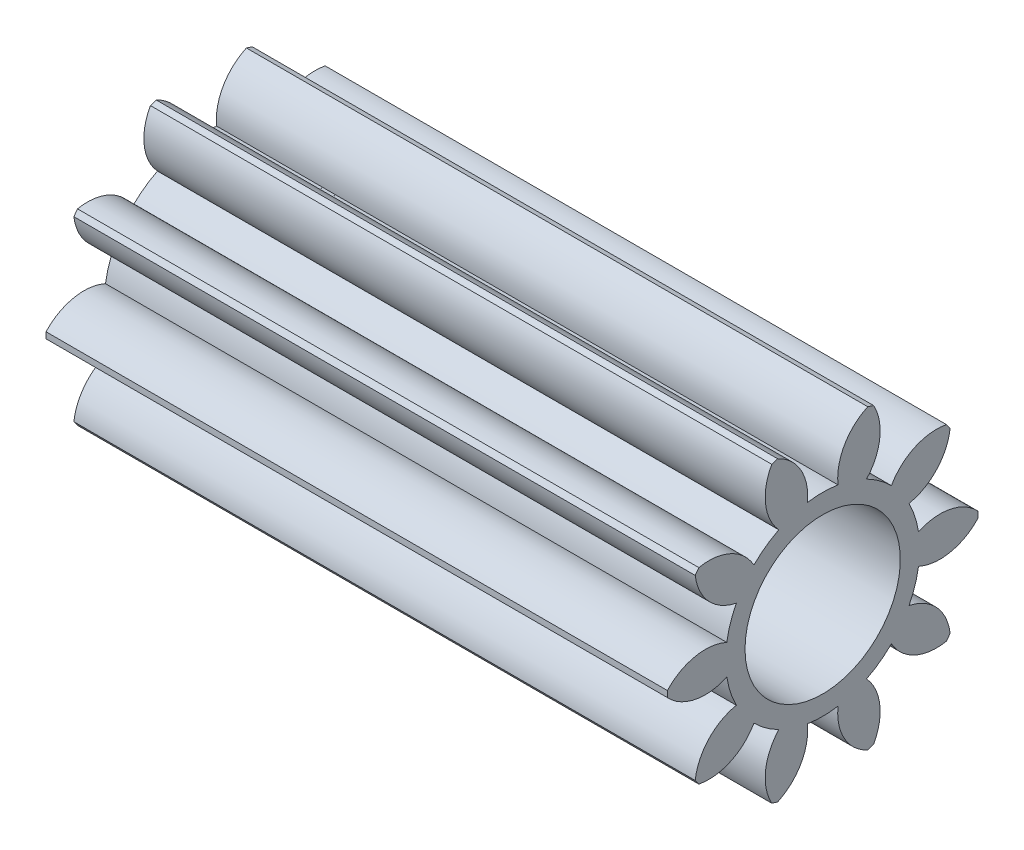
SolidWorks part; units mm, degrees
ref_plane "Plane1" through (0, 0, 0) normal (0, 0, 1) x (1, 0, 0)
ref_plane "Plane2" through (0, 0, 0) normal (0, 1, 0) x (1, 0, 0)
ref_plane "Plane3" through (0, 0, 0) normal (1, 0, 0) x (0, 0, -1)
sketch "HoldingSke" plane through (0, 0, 0) normal (0, 1, 0) x (1, 0, 0)
  line L0 (0, 0) -> (1.9696, -0.3473)
  line L1 (-15, 0) -> (100, 0) construction
  line L2 (0, 0) -> (-2.1039, 2.3779)
  line L3 (0, 0) -> (-11.863, 4.5341)
  line L4 (0, 0) -> (8.5048, 1.4996)
  line L5 (0, 0) -> (-46.8476, -17.4728)
  line L6 (0, 0) -> (-9.9476, -6.7116)
  line L7 (-2.1039, 2.3779) -> (8.6586, 51.2059)
  line L8 (-76.2, 54.61) -> (-75.7, 54.61)
  line L9 (-71.009, 38.7566) -> (-53.1078, 45.2721)
  line L10 (-76.2, 71.12) -> (104.1128, 71.12)
  line L11 (0, 0) -> (-12, 0)
  line L12 (-76.2, 101.6) -> (-76.181, 101.6)
  line L13 (24.9733, 27.94) -> (52.9518, 28.4284)
  line L14 (24.9733, 27.94) -> (24.9743, 27.94)
  line L15 (24.9733, 27.94) -> (100.4006, 29.5858)
  line L16 (-63.627, -0.5) -> (-12.827, -0.5)
  circle A0 centre (0, 0) radius 1.5
  circle A1 centre (0, 0) radius 1.874
  circle A2 centre (0, 0) radius 37.5
  circle A3 centre (0, 0) radius 1.5
sketch "BasProSke" plane through (0, 0, 0) normal (0, 1, 0) x (1, 0, 0)
  line L0 (-10, 0) -> (60, 0) construction
  line L1 (0, 0) -> (0, 3)
  line L2 (0, 0) -> (12, 0)
  line L3 (12, 0) -> (12, 3)
  line L4 (12, 3) -> (0, 3)
revolve "Base-Revolve" add sketch "BasProSke" angle 360 about L0
sketch "TooCutSke" plane through (0, 0, 0) normal (1, 0, 0) x (0, 0, -1)
  line L1 (0, 0) -> (0, 107) construction
  line L2 (0, 0) -> (-0.4243, 2.4637) construction
  line L3 (0, 0) -> (-1.5292, 4.7063) construction
  line L4 (-0.4243, 2.4637) -> (-0.7646, 2.3532) construction
  arc A0 (0.2964, 1.8504) -> (-0.2964, 1.8504) centre (0, 0) ccw
  arc A1 (0.9059, 2.8866) -> (-0.9059, 2.8866) centre (0, 0) ccw
  circle A2 centre (0, 0) radius 2.5 construction
  circle A3 centre (0, 0) radius 2.3492 construction
  arc A4 (-0.2964, 1.8504) -> (-0.9059, 2.8866) centre (-1.2901, 1.9633) ccw
  arc A5 (0.9059, 2.8866) -> (0.2964, 1.8504) centre (1.2901, 1.9633) ccw
extrude "ToothCut" cut sketch "TooCutSke" along normal through all
fillet "Breaks" [suppressed] radius 0.01
fillet "RootFillets" [suppressed] radius 0.126
pattern_circular "TeethCuts" count 10 every 36 about axis through (-10, 0, 0) along (1, 0, 0) of "ToothCut", "RootFillets", "Breaks"
sketch "HubNeaOneSke" plane through (0, 0, 0) normal (-1, 0, 0) x (0, 0, 1)
  circle A0 centre (0, 0) radius 1.874
extrude "HubNearOne" [suppressed] add sketch "HubNeaOneSke" along normal blind 38.0001
sketch "HubNeaBotSke" plane through (0, 0, 0) normal (-1, 0, 0) x (0, 0, 1)
  circle A0 centre (0, 0) radius 1.874
extrude "HubNearBoth" [suppressed] add sketch "HubNeaBotSke" along normal blind 19
ref_plane "FarPln" through (12, 0, 0) normal (1, 0, 0) x (0, 0, -1)
sketch "HubFarSke" plane through (12, 0, 0) normal (1, 0, 0) x (0, 0, -1)
  circle A0 centre (0, 0) radius 1.874
extrude "HubFar" [suppressed] add sketch "HubFarSke" along normal blind 19
sketch "BorSke" plane through (0, 0, 0) normal (1, 0, 0) x (0, 0, -1)
  circle A0 centre (0, 0) radius 1.5
extrude "Bore" cut sketch "BorSke" along normal mid plane 100.0001
sketch "KeySke" plane through (0, 0, 0) normal (1, 0, 0) x (0, 0, -1)
  line L0 (-0.6, 0) -> (-0.6, 2)
  line L1 (-0.6, 2) -> (0.6, 2)
  line L2 (0.6, 2) -> (0.6, 0)
  line L3 (0, 0) -> (0, 34) construction
  line L4 (-0.6, 0) -> (0.6, 0)
extrude "Keyway" [suppressed] cut sketch "KeySke" along normal mid plane 100.0001
pattern_circular "Keyway2" [suppressed] count 2 every 90 about axis through (-10, 0, 0) along (1, 0, 0)
equation "' \"Module@HoldingSke\" = 6.35"
equation "' \"Num_teeth@HoldingSke\" = 12"
equation "' \"Ap@HoldingSke\" =  20"
equation "' \"Ap@HoldingSke\" = 20"
equation "' \"Width@HoldingSke\" = 0.5 * 25.4"
equation "' \"Hub_dia@HoldingSke\"= 1 * 25.4"
equation "' \"Hub_dia@HoldingSke\" = 1 * 25.4"
equation "' \"Overall_len@HoldingSke\" = 1.0 * 25.4"
equation "' \"Bore@HoldingSke\" = 0.75 * 25.4"
equation "' \"T_dim@HoldingSke\" = 0.1 * 25.4"
equation "' \"Width@KeySke\" = 0.25 * 25.4"
equation "' \"Show_teeth@HoldingSke\" = 13"
equation "' \"Backlash@HoldingSke\" = 0.009 * 25.4"
equation "' \"Addendum_fac@HoldingSke\" = 1.0"
equation "' \"Dedendum_fac@HoldingSke\" = 1.25"
equation "' \"Dedendum_add@HoldingSke\" = 0.00005 * 25.4"
equation "' \"Clearance_fac@HoldingSke\" = 0.25"
equation "\"Pitch@HoldingSke\" = 1 / \"Module@HoldingSke\""
equation "\"Overcut_dia@TooCutSke\" = (\"Num_teeth@HoldingSke\" + 2 * \"Addendum_fac@HoldingSke\") / \"Pitch@HoldingSke\" + 0.002 * 25.4"
equation "\"Pitch_dia@TooCutSke\" = \"Num_teeth@HoldingSke\" / \"Pitch@HoldingSke\""
equation "\"Base_dia@TooCutSke\" = \"Num_teeth@HoldingSke\" / \"Pitch@HoldingSke\" * cos((\"Ap@HoldingSke\"  * 3.14159265 / 180))"
equation "\"Root_dia@TooCutSke\" = (\"Num_teeth@HoldingSke\" + 2) / \"Pitch@HoldingSke\" - 2 * (\"Addendum_fac@HoldingSke\" + \"Dedendum_fac@HoldingSke\") / \"Pitch@HoldingSke\" - \"Dedendum_add@HoldingSke\" * 2"
equation "\"Half_ang@TooCutSke\" = 180 / \"Num_teeth@HoldingSke\""
equation "\"Half_CT@TooCutSke\" = \"Num_teeth@HoldingSke\" / \"Pitch@HoldingSke\" * sin((3.14159265 / 2 / \"Num_teeth@HoldingSke\")) / 2 - 7 * \"Backlash@HoldingSke\" / 4"
equation "\"Flank_rad@TooCutSke\" = \"Num_teeth@HoldingSke\" / \"Pitch@HoldingSke\" / 5"
equation "\"Radius@RootFillets\" = \"Clearance_fac@HoldingSke\" / \"Pitch@HoldingSke\" + \"Dedendum_add@HoldingSke\""
equation "\"Break_rad@Breaks\" = 0.02 / \"Pitch@HoldingSke\""
equation "\"Thickness@HoldingSke\" = \"Width@HoldingSke\""
equation "\"OAL@HoldingSke\" = \"Thickness@HoldingSke\""
equation "\"MHD@HoldingSke\" = (\"Num_teeth@HoldingSke\" + 2) / \"Pitch@HoldingSke\" - 2 * (\"Addendum_fac@HoldingSke\" + \"Dedendum_fac@HoldingSke\")  / \"Pitch@HoldingSke\" - \"Dedendum_add@HoldingSke\" * 2"
equation "\"MBD@HoldingSke\" = (\"Num_teeth@HoldingSke\" + 2) / \"Pitch@HoldingSke\" - 2 * (\"Addendum_fac@HoldingSke\" + \"Dedendum_fac@HoldingSke\")  / \"Pitch@HoldingSke\" - \"Dedendum_add@HoldingSke\" * 2 - 0.002 * 25.4"
equation "\"MHD@HoldingSke\" = ((sgn( \"MHD@HoldingSke\" - \"Hub_dia@HoldingSke\" )-1)*( \"MHD@HoldingSke\" - \"Hub_dia@HoldingSke\" ))/-2+ \"Hub_dia@HoldingSke\""
equation "\"MBD@HoldingSke\" = ((sgn( \"MBD@HoldingSke\" - \"Bore@HoldingSke\" )-1)*( \"MBD@HoldingSke\" - \"Bore@HoldingSke\" ))/-2+ \"Bore@HoldingSke\""
equation "\"OAL@HoldingSke\" = ((sgn( \"OAL@HoldingSke\" - \"Overall_len@HoldingSke\" )+1)*( \"OAL@HoldingSke\" - \"Overall_len@HoldingSke\" ))/2 + \"Overall_len@HoldingSke\" + 0.000002 * 25.4"
equation "\"Num_teeth@TeethCuts\" = int( \"Show_teeth@HoldingSke\" ) + 1"
equation "\"Num_teeth@TeethCuts\" = ((sgn( \"Num_teeth@TeethCuts\" - \"Num_teeth@HoldingSke\" )-1)*( \"Num_teeth@TeethCuts\" - \"Num_teeth@HoldingSke\" ))/-2+ \"Num_teeth@HoldingSke\""
equation "\"Num_teeth@TeethCuts\" = ((sgn( \"Num_teeth@TeethCuts\" - 2.0)+1)*( \"Num_teeth@TeethCuts\" - 2.0))/2 +2.0"
equation "\"Angle@TeethCuts\" = 360.0 / \"Num_teeth@HoldingSke\""
equation "\"Diameter@BasProSke\" = (\"Num_teeth@HoldingSke\" + 2 * \"Addendum_fac@HoldingSke\") / \"Pitch@HoldingSke\""
equation "\"Thickness@BasProSke\"  = \"Thickness@HoldingSke\""
equation "' \"Fillet_rad@BasProSke\" =  \"Thickness@HoldingSke\" * 0.05"
equation "' \"Fillet_rad@BasProSke\" = \"Thickness@HoldingSke\" * 0.05"
equation "\"MHD@HoldingSke\" = ((sgn( \"MHD@HoldingSke\" - \"Root_dia@TooCutSke\" )-1)*( \"MHD@HoldingSke\" - \"Root_dia@TooCutSke\" ))/-2+ \"Root_dia@TooCutSke\""
equation "\"Diameter@HubNeaOneSke\" = \"MHD@HoldingSke\""
equation "\"Length@HubNearOne\" = \"OAL@HoldingSke\" - \"Thickness@BasProSke\""
equation "\"Diameter@HubNeaBotSke\" = \"MHD@HoldingSke\""
equation "\"Length@HubNearBoth\" = ( \"OAL@HoldingSke\" - \"Thickness@BasProSke\" ) / 2.0"
equation "\"Thickness@FarPln\" = \"Thickness@BasProSke\""
equation "\"Diameter@HubFarSke\" = \"MHD@HoldingSke\""
equation "\"Length@HubFar\" = ( \"OAL@HoldingSke\" - \"Thickness@BasProSke\" ) / 2.0"
equation "\"Diameter@BorSke\" = \"MBD@HoldingSke\""
equation "\"D1@Bore\" = \"OAL@HoldingSke\" * 2.0"
equation "\"D1@Keyway\" = \"OAL@HoldingSke\" * 2.0"
equation "\"Offset@KeySke\" = \"T_dim@HoldingSke\" + \"MBD@HoldingSke\" / 2.0"
